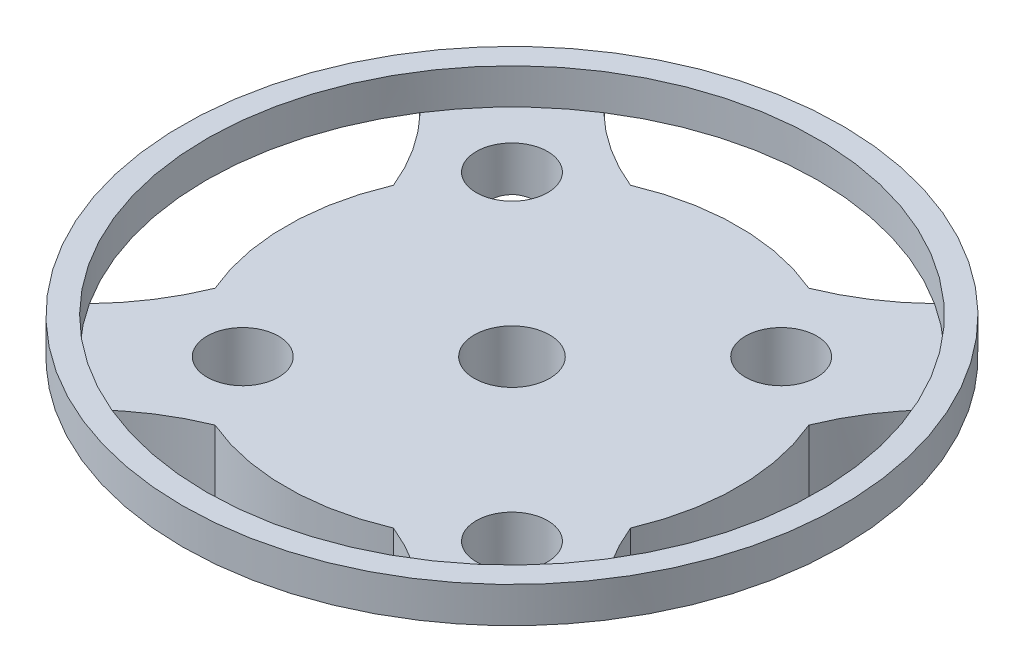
SolidWorks part; units mm, degrees
ref_plane "Front Plane" through (0, 0, 0) normal (0, 0, 1) x (1, 0, 0)
ref_plane "Top Plane" through (0, 0, 0) normal (0, 1, 0) x (1, 0, 0)
ref_plane "Right Plane" through (0, 0, 0) normal (1, 0, 0) x (0, 0, -1)
ref_plane "Plane4" through (0, 0, 1.6) normal (0, 0, 1) x (1, 0, 0)
sketch "Sketch6" plane through (0, 0, 0) normal (0, 1, 0) x (1, 0, 0)
  line L0 (-20.8341, 0) -> (462.4036, -351.4962) construction
  line L1 (-419.87, 507.7872) -> (246.7967, 507.7872) construction
  line L2 (-481.9118, 739.8903) -> (184.7549, 739.8903) construction
  line L3 (-11.7604, 8.9167) -> (112.7465, 8.9167) construction
  line L4 (13.85, -21.6) -> (8, -26.6)
  line L5 (1.585, -40) -> (-1.585, -40)
  line L6 (1.585, -40) -> (1.585, 0)
  line L19 (1.585, 0) -> (-1.585, 0)
  line L32 (-1.585, -40) -> (-1.585, 0)
  line L33 (8, -26.6) -> (1.585, -26.6)
  line L34 (13.85, -21.6) -> (-13.85, -21.6)
  line L35 (13.85, -21.6) -> (13.85, -4.6)
  line L36 (13.85, -4.6) -> (11.5, -4.6)
  line L37 (-13.85, -21.6) -> (-13.85, -4.6)
  line L39 (8.1821, -21.6) -> (-7.8179, -21.6)
  line L41 (-8, -26.6) -> (-13.85, -21.6)
  line L42 (-1.585, -1.6) -> (-9.5, -1.6)
  line L47 (9.5, -1.6) -> (1.585, -1.6)
  line L48 (0, 2.7423) -> (0, -45.474) construction
  line L49 (5, -28.6) -> (1.585, -28.6)
  line L50 (-5, -28.6) -> (-5, -26.6)
  line L51 (5, -28.6) -> (5, -26.6)
  line L54 (-1.585, -26.6) -> (-8, -26.6)
  line L55 (-1.585, -28.6) -> (-5, -28.6)
  line L57 (-13.085, -4.6) -> (-13.85, -4.6)
  line L58 (1.585, -26.6) -> (-1.585, -26.6)
  line L59 (-1.585, -1.6) -> (-9.5, -1.6)
  line L60 (-8.0001, -1.6) -> (8.0001, -1.6)
  line L61 (11.5, -4.6) -> (-13.085, -4.6)
  line L62 (13.85, -4.6) -> (13.85, -6.1)
  line L63 (9.5, -1.6) -> (1.585, -1.6)
  line L64 (13.85, -6.1) -> (-13.85, -6.1)
  line L65 (-13.85, -6.1) -> (-13.85, -6.6)
  line L66 (-13.85, -6.6) -> (13.85, -6.6)
  line L67 (13.85, -6.6) -> (13.85, -6.1)
  line L68 (9.5, -1.6) -> (13.85, -4.6)
  line L69 (-9.5, -1.6) -> (-13.85, -4.6)
  line L70 (0, 0) -> (0, 127.1357) construction
  line L71 (-64.8768, 63.5679) -> (64.8768, 63.5679) construction
  circle A0 centre (0, 63.5679) radius 1.585
  point P15 (-0.0481, -22.7528)
  point P44 (0, -1.6)
  point P51 (0, -26.6)
  dimension "D5" = 11.5
  dimension "D20" = 3.17
  dimension "D21" = 5
  dimension "D22" = 5
  dimension "D2" = 40
  dimension "D3" = 13.85
  dimension "D4" = 2
  dimension "D6" = 3
  dimension "D7" = 1.6
  dimension "D8" = 13.85
  dimension "D9" = 11.5
  dimension "D10" = 5
  dimension "D11" = 5
  dimension "D12" = 9.5
  dimension "D13" = 9.5
  dimension "D14" = 1.585
  dimension "D15" = 1.585
  dimension "D16" = 8
  dimension "D17" = 1.585
  dimension "D18" = 8
  dimension "D19" = 1.585
  dimension "D23" = 25
  dimension "D24" = 0.5
extrude "Boss-Extrude2" add sketch "Sketch6" along normal blind 40 contours A0
ref_plane "Plane6" through (0, 1.6, 0) normal (0, 1, 0) x (1, 0, 0)
sketch "Sketch7" plane through (0, 1.6, 0) normal (0, 1, 0) x (1, 0, 0)
  circle A0 centre (0, 63.5679) radius 9.5
  dimension "D1" = 19
ref_plane "Plane8" through (0, 4.6, 0) normal (0, 1, 0) x (1, 0, 0)
sketch "Sketch8" plane through (0, 4.6, 0) normal (0, 1, 0) x (1, 0, 0)
  line L0 (0, 0) -> (0, 127.1357) construction
  circle A0 centre (0, 63.5679) radius 13.85
loft "Loft3" add profiles "Sketch7", "Sketch8"
sketch "Sketch9" plane through (0, 4.6, 0) normal (0, 1, 0) x (1, 0, 0)
  circle A0 centre (0, 63.5679) radius 13.85
  circle A1 centre (0, 63.5679) radius 12.85
extrude "Boss-Extrude3" add sketch "Sketch9" along normal blind 1.5
sketch "Sketch13" plane through (0, 1.6, 0) normal (0, -1, 0) x (1, 0, 0)
  line L0 (88.745, 433.9159) -> (751.1042, 515.2434) construction
  line L2 (-8.1092, -63.5679) -> (-8, -63.5679)
  circle A0 centre (0, -63.5679) radius 13.85
  arc A3 (-7.6424, -52.0172) -> (7.6424, -52.0172) centre (0, -45.5679) ccw
  arc A4 (-7.6424, -75.1185) -> (7.6424, -75.1185) centre (0, -81.5679) cw
  arc A5 (-11.5506, -71.2102) -> (-11.5506, -55.9255) centre (-18, -63.5679) ccw
  arc A6 (11.5506, -71.2102) -> (11.5506, -55.9255) centre (18, -63.5679) cw
  circle A7 centre (-5.6569, -57.911) radius 1.5
  circle A8 centre (-6.7175, -70.2854) radius 1.5
  circle A9 centre (5.6569, -69.2247) radius 1.5
  circle A10 centre (6.7175, -56.8503) radius 1.5
  dimension "D1" = 27.7
  dimension "D4" = 10
extrude "Cut-Extrude2" cut sketch "Sketch13" against normal blind 3
sketch "Sketch15" plane through (0, 40, 0) normal (0, 1, 0) x (1, 0, 0)
  circle A0 centre (0, 63.5679) radius 1.585
extrude "Cut-Extrude3" cut sketch "Sketch15" against normal blind 40
